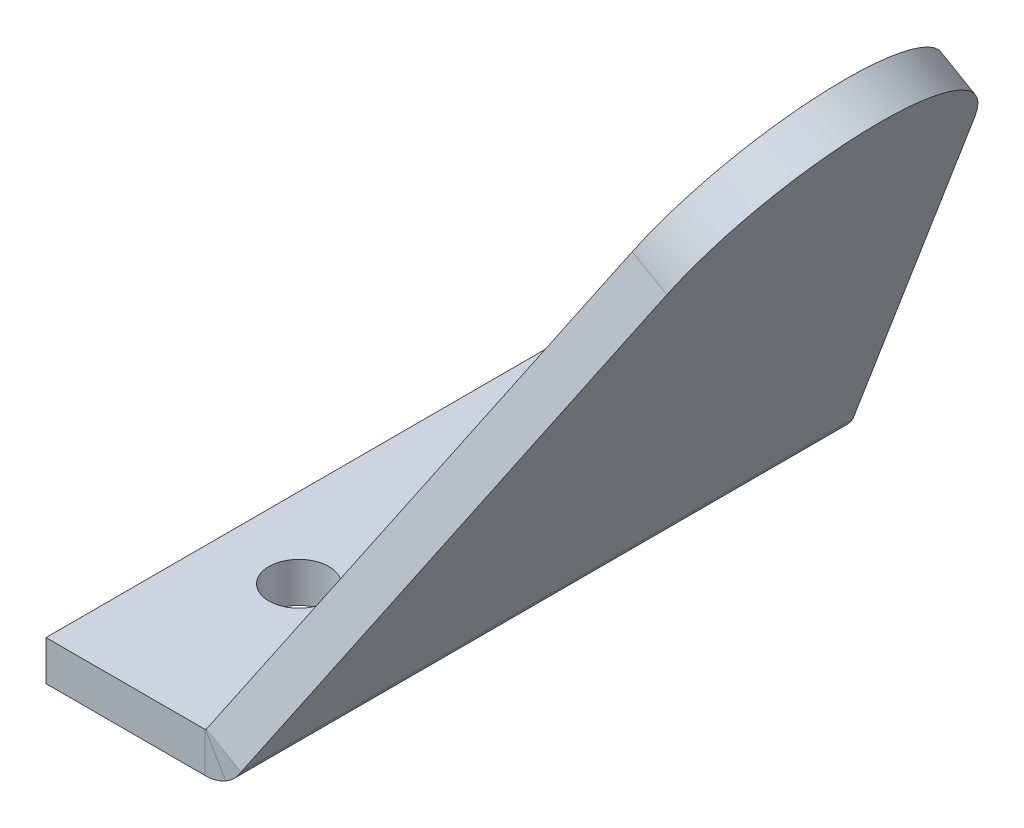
SolidWorks part; units mm, degrees
ref_plane "Front Plane" through (0, 0, 0) normal (0, 0, 1) x (1, 0, 0)
ref_plane "Top Plane" through (0, 0, 0) normal (0, 1, 0) x (1, 0, 0)
ref_plane "Right Plane" through (0, 0, 0) normal (1, 0, 0) x (0, 0, -1)
sketch "Sketch1" plane through (0, 0, 0) normal (0, 1, 0) x (1, 0, 0)
  line L0 (0, 23) -> (50, 23) construction
  line L1 (0, 0) -> (12, 0)
  line L2 (0, 0) -> (0, 46)
  line L3 (0, 46) -> (12, 46)
  line L4 (12, 46) -> (53.2091, 34.5629)
  line L5 (12, 0) -> (53.2091, 11.4371)
  line L6 (6, 46) -> (6, 0) construction
  arc A0 (53.2091, 11.4371) -> (53.2091, 34.5629) centre (50, 23) ccw
  circle A1 centre (6, 33) radius 2.25
  circle A2 centre (6, 13) radius 2.25
  dimension "D4" = 12
  dimension "D5" = 12
  dimension "D6" = 4.5
  dimension "D7" = 10
  dimension "D8" = 10
  dimension "D1" = 46
  dimension "D2" = 12
  dimension "D3" = 50
sheet metal parameters "Sheet-Metal1" thickness 3 parameters "D1"=0.0001
base flange "Base-Flange1" sketch "Sketch1" thickness 3 reverse thickness direction yes parameters "D1"=0.0001
sketch "Sketch3" plane through (0, 3, 0) normal (0, 1, 0) x (1, 0, 0)
  line L0 (12, 46) -> (12, 0)
sketched bend "Sketched Bend5" parameters "D1"=0.1
bend "SketchBend5" bend radius 0.1 bend angle 60 parameters "D5"=1
flat pattern "Flat-Pattern1"
sketch "Bend-Lines1" plane through (0, 0, 0) normal (0, 1, 0) x (-1, 0, 0)
bend of the flat pattern "Flatten-<SketchBend5>1"
